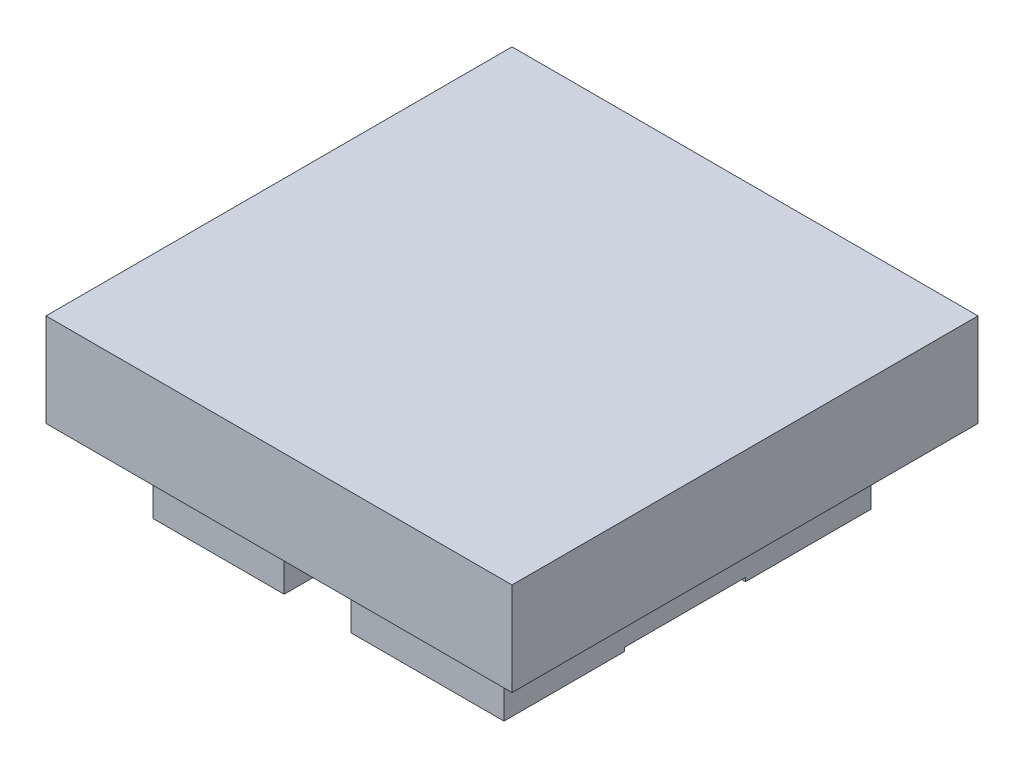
SolidWorks part; units mm, degrees
ref_plane "Plan de face" through (0, 0, 0) normal (0, 0, 1) x (1, 0, 0)
ref_plane "Plan de dessus" through (0, 0, 0) normal (0, 1, 0) x (1, 0, 0)
ref_plane "Plan de droite" through (0, 0, 0) normal (1, 0, 0) x (0, 0, -1)
sketch "Esquisse1" plane through (0, 0, 0) normal (0, 0, 1) x (1, 0, 0)
  line L1 (0, 0) -> (250, 0)
  line L2 (0, 0) -> (0, 50)
  line L3 (0, 50) -> (250, 50)
  line L4 (250, 0) -> (250, 50)
  dimension "D1" = 250
  dimension "D2" = 50
extrude "Boss.-Extru.1" add sketch "Esquisse1" along normal blind 250
sketch "Esquisse2" plane through (0, 0, 0) normal (0, -1, 0) x (1, 0, 0)
  line L1 (32.8966, 225.4535) -> (103.2393, 225.4535)
  line L2 (32.8966, 225.4535) -> (32.8966, 28.595)
  line L3 (32.8966, 28.595) -> (103.2393, 28.595)
  line L4 (103.2393, 225.4535) -> (103.2393, 28.595)
  line L5 (139.1698, 225.4535) -> (221.152, 225.4535)
  line L6 (139.1698, 225.4535) -> (139.1698, 28.595)
  line L7 (139.1698, 28.595) -> (221.152, 28.595)
  line L8 (221.152, 225.4535) -> (221.152, 28.595)
extrude "Boss.-Extru.2" add sketch "Esquisse2" along normal blind 40
sketch "Esquisse3" plane through (0, -40, 0) normal (0, -1, 0) x (1, 0, 0)
  line L1 (-73.8827, 160.6774) -> (270.7461, 160.6774)
  line L2 (-73.8827, 160.6774) -> (-73.8827, 95.9014)
  line L3 (-73.8827, 95.9014) -> (270.7461, 95.9014)
  line L4 (270.7461, 160.6774) -> (270.7461, 95.9014)
extrude "Enlèv. mat.-Extru.1" cut sketch "Esquisse3" against normal blind 2
sketch "Esquisse4" plane through (0, -40, 0) normal (0, -1, 0) x (1, 0, 0)
  line L1 (151.3153, 211.7898) -> (209.5125, 211.7898)
  line L2 (151.3153, 211.7898) -> (151.3153, 171.3048)
  line L3 (151.3153, 171.3048) -> (209.5125, 171.3048)
  line L4 (209.5125, 211.7898) -> (209.5125, 171.3048)
  line L5 (200.9094, 153.5926) -> (209.5125, 153.5926)
  line L6 (200.9094, 153.5926) -> (200.9094, 136.8925)
  line L7 (200.9094, 136.8925) -> (209.5125, 136.8925)
  line L8 (209.5125, 153.5926) -> (209.5125, 136.8925)
  line L9 (56.6815, 145.2425) -> (81.4786, 145.2425)
  line L10 (56.6815, 145.2425) -> (56.6815, 136.8925)
  line L11 (56.6815, 136.8925) -> (81.4786, 136.8925)
  line L12 (81.4786, 145.2425) -> (81.4786, 136.8925)
  line L13 (56.6815, 132.3379) -> (81.4786, 132.3379)
  line L14 (56.6815, 132.3379) -> (56.6815, 122.7227)
  line L15 (56.6815, 122.7227) -> (81.4786, 122.7227)
  line L16 (81.4786, 132.3379) -> (81.4786, 122.7227)
extrude "Boss.-Extru.3" add sketch "Esquisse4" along normal blind 1 and the other way blind 12
